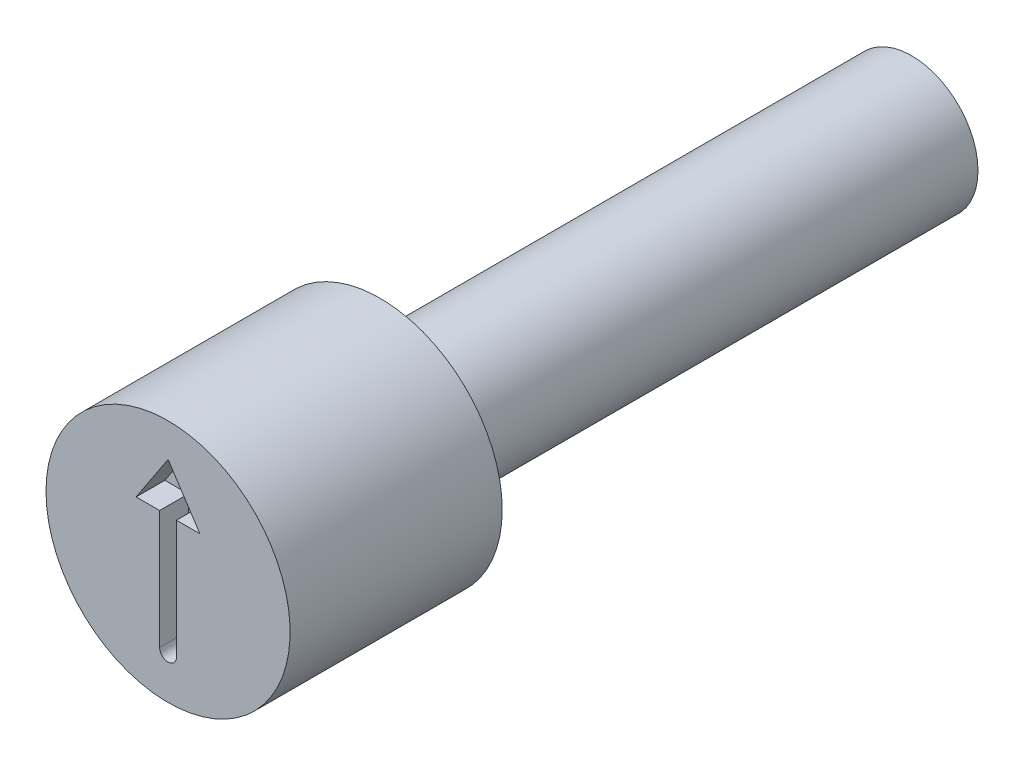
SolidWorks part; units mm, degrees
ref_plane "Front Plane" through (0, 0, 0) normal (0, 0, 1) x (1, 0, 0)
ref_plane "Top Plane" through (0, 0, 0) normal (0, 1, 0) x (1, 0, 0)
ref_plane "Right Plane" through (0, 0, 0) normal (1, 0, 0) x (0, 0, -1)
imported_body "Imported1"
other "DeleteFace1"
sketch "Sketch3" plane through (0, 0, 0) normal (0, 1, 0) x (1, 0, 0)
  line L1 (2.3, 2.9972) -> (0, 2.9972)
  line L2 (2.3, 2.9972) -> (2.3, 3.9972)
  line L3 (2.3, 3.9972) -> (0, 3.9972)
  line L4 (0, 2.9972) -> (0, 3.9972)
  dimension "D1" = 1
  dimension "D2" = 2.3
revolve "Revolve1" add sketch "Sketch3" angle 360 about L4
